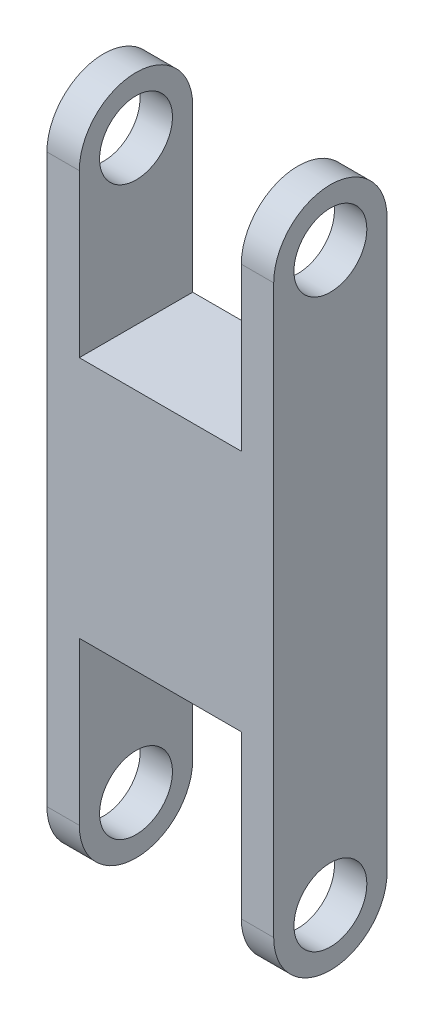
SolidWorks part; units mm, degrees
ref_plane "Front Plane" through (0, 0, 0) normal (0, 0, 1) x (1, 0, 0)
ref_plane "Top Plane" through (0, 0, 0) normal (0, 1, 0) x (1, 0, 0)
ref_plane "Right Plane" through (0, 0, 0) normal (1, 0, 0) x (0, 0, -1)
sketch "Sketch2" plane through (0, 0, 0) normal (1, 0, 0) x (0, 0, -1)
  line L0 (0, 175) -> (0, -175)
  line L1 (70, -175) -> (70, 175)
  arc A0 (0, -175) -> (70, -175) centre (35, -175) ccw
  arc A1 (70, 175) -> (0, 175) centre (35, 175) ccw
  circle A2 centre (35, 175) radius 22.5
  circle A3 centre (35, -175) radius 22.5
  point P4 (0, 0)
  dimension "D1" = 45
  dimension "D2" = 45
  dimension "D4" = 70
  dimension "D3" = 350
extrude "Boss-Extrude1" add sketch "Sketch2" along normal blind 20
ref_plane "Plane1" through (-50, 0, 0) normal (1, 0, 0) x (0, 0, -1)
sketch "Sketch3" plane through (0, 0, 0) normal (-1, 0, 0) x (0, 0, 1)
  line L0 (-70, -175) -> (-70, 175) construction
  line L1 (-70, 75) -> (0, 75)
  line L2 (-70, 75) -> (-70, -75)
  line L3 (-70, -75) -> (0, -75)
  line L4 (0, 75) -> (0, -75)
  line L5 (0, 175) -> (0, -175) construction
  line L6 (-35, 175) -> (-35, 75) construction
  line L7 (-35, -175) -> (-35, -75) construction
  dimension "D1" = 100
extrude "Boss-Extrude2" add sketch "Sketch3" along normal up to surface (50 mm away)
mirror "Mirror5" about plane through (-50, 0, 0) normal (1, 0, 0) of "Boss-Extrude2"
sketch "Sketch4" plane through (-100, 0, 0) normal (-1, 0, 0) x (0, 0, 1)
  line L0 (-70, -175) -> (-70, 175)
  line L1 (0, 175) -> (0, -175)
  arc A0 (-70, 175) -> (0, 175) centre (-35, 175) cw
  arc A1 (0, -175) -> (-70, -175) centre (-35, -175) cw
  circle A2 centre (-35, 175) radius 22.5
  circle A3 centre (-35, -175) radius 22.5
  dimension "D1" = 45
  dimension "D2" = 45
extrude "Boss-Extrude3" add sketch "Sketch4" along normal blind 20
